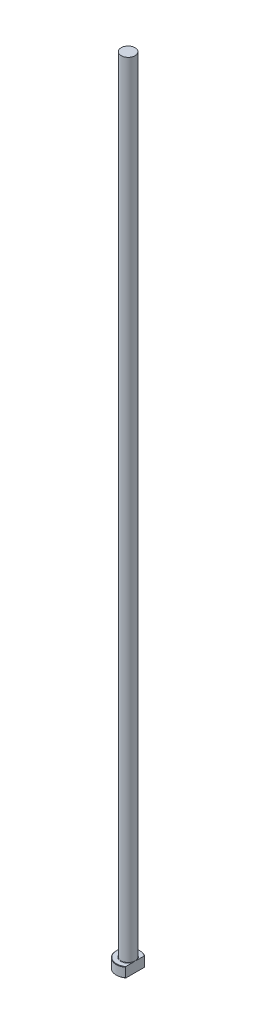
SolidWorks part; units mm, degrees
ref_plane "Front Plane" through (0, 0, 0) normal (0, 0, 1) x (1, 0, 0)
ref_plane "Top Plane" through (0, 0, 0) normal (0, 1, 0) x (1, 0, 0)
ref_plane "Right Plane" through (0, 0, 0) normal (1, 0, 0) x (0, 0, -1)
sketch "Sketch1" plane through (0, 0, 0) normal (0, 0, 1) x (1, 0, 0)
  line L0 (0, 259.9588) -> (0, -15.1925) construction
  line L1 (0, 0) -> (-6, 0)
  line L2 (-6, 0) -> (-6, 5)
  line L3 (-6, 5) -> (-3.5, 5)
  line L4 (-3.5, 5) -> (-3.5, 400)
  line L5 (-3.5, 400) -> (0, 400)
  line L6 (0, 400) -> (0, 0)
  dimension "L" = 400
  dimension "H" = 12
  dimension "T" = 5
  dimension "D" = 7
revolve "Revolve1" add sketch "Sketch1" angle 360 about L0
chamfer "Chamfer1" distance 0.2 angle 45 2 edges at (0, 5, 6) (0, 0, 6)
fillet "Fillet1" radius 0.2 1 edges at (0, 5, 3.5)
sketch "Sketch2" plane through (0, 0, 0) normal (0, 1, 0) x (1, 0, 0)
  line L0 (3.5, 4.8734) -> (3.5, -4.8734)
  circle A0 centre (0, 0) radius 6 construction
  arc A1 (3.5, -4.8734) -> (3.5, 4.8734) centre (0, 0) ccw
  circle A2 centre (0, 0) radius 3.5 construction
extrude "KEY" cut sketch "Sketch2" along normal through all
